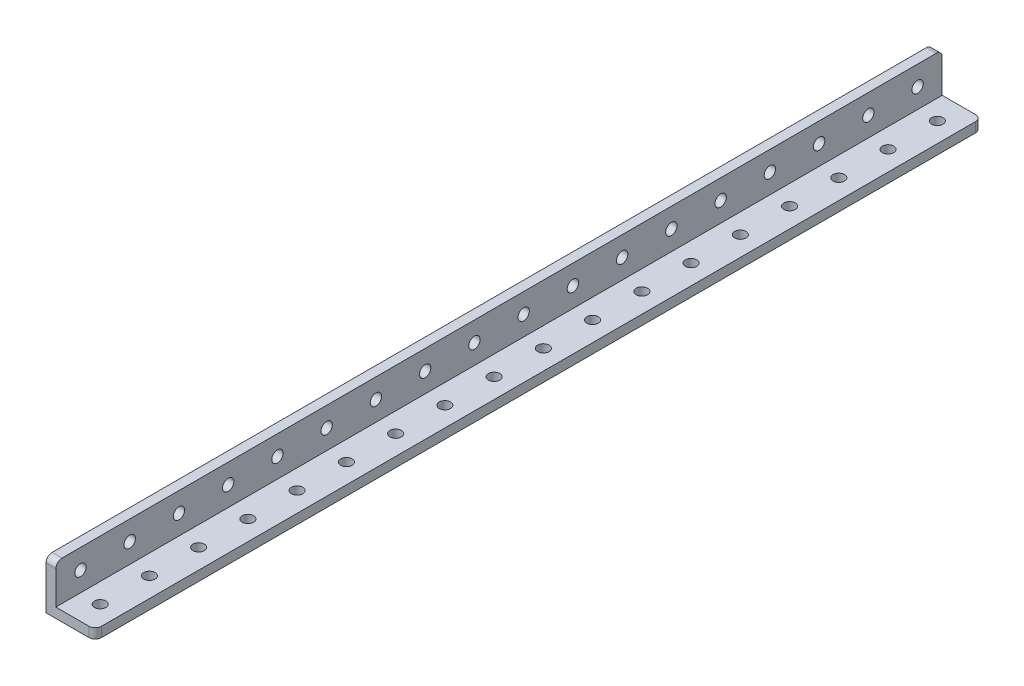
SolidWorks part; units mm, degrees
ref_plane "Front Plane" through (0, 0, 0) normal (0, 0, 1) x (1, 0, 0)
ref_plane "Top Plane" through (0, 0, 0) normal (0, 1, 0) x (1, 0, 0)
ref_plane "Right Plane" through (0, 0, 0) normal (1, 0, 0) x (0, 0, -1)
sketch "Sketch1" plane through (0, 0, 0) normal (0, 0, 1) x (1, 0, 0)
  line L0 (0, 0) -> (16, 0)
  line L1 (16, 0) -> (16, 3.2)
  line L2 (16, 3.2) -> (3.2, 3.2)
  line L3 (3.2, 3.2) -> (3.2, 16)
  line L4 (3.2, 16) -> (0, 16)
  line L5 (0, 16) -> (0, 0)
  dimension "D1" = 16
  dimension "D2" = 3.2
  dimension "D3" = 16
  dimension "D4" = 3.2
extrude "Extrude1" add sketch "Sketch1" against normal blind 288
sketch "Sketch2"
sketch_block_instance "Block2-1"
sketch_block "Block2" parameters "D1"=3.7, "D2"=16, "D3"=16, "D4"=16, "D5"=16, "D6"=16, "D7"=16, "D8"=16, "D9"=16, "D10"=16, "D11"=16, "D12"=16, "D13"=16, "D14"=16
extrude "Cut-Extrude1" cut sketch "Sketch2" against normal through all
sketch "Sketch3" plane through (0, 0, 0) normal (0, -1, 0) x (1, 0, 0)
  line L0 (0, -288) -> (16, -288) construction
  line L1 (16, -288) -> (16, 0) construction
  dimension "D1" = 8
  dimension "D2" = 6.4
sketch_block_instance "Block2-2"
extrude "Cut-Extrude2" cut sketch "Sketch3" against normal through all
fillet "Fillet1" radius 2 1 edges at (1.6, 16, 0)
fillet "Fillet2" radius 2 1 edges at (16, 1.6, 0)
fillet "Fillet3" radius 2 1 edges at (1.6, 16, -288)
fillet "Fillet4" radius 2 1 edges at (16, 1.6, -288)
